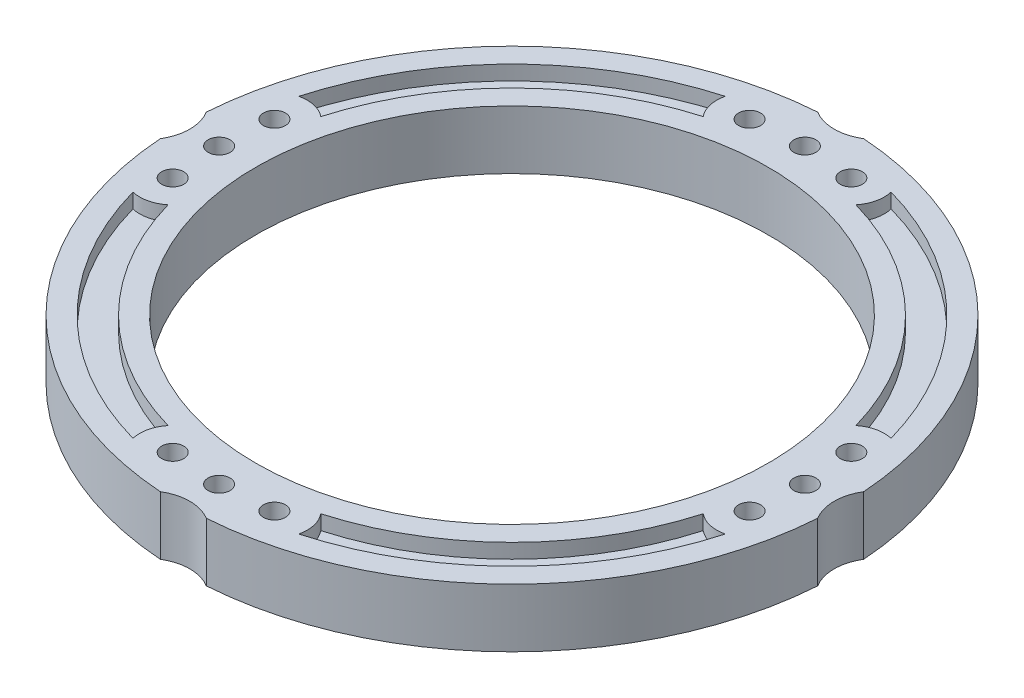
SolidWorks part; units mm, degrees
ref_plane "Front Plane" through (0, 0, 0) normal (0, 0, 1) x (1, 0, 0)
ref_plane "Top Plane" through (0, 0, 0) normal (0, 1, 0) x (1, 0, 0)
ref_plane "Right Plane" through (0, 0, 0) normal (1, 0, 0) x (0, 0, -1)
sketch "Sketch1" plane through (0, 0, 0) normal (0, 1, 0) x (1, 0, 0)
  line L0 (0, 40) -> (0, 0) construction
  line L1 (0, 0) -> (-6.9459, 39.3923) construction
  line L2 (0, 0) -> (6.9459, 39.3923) construction
  circle A0 centre (0, 0) radius 40 construction
  circle A1 centre (0, 40) radius 1.5
  circle A2 centre (40, 0) radius 1.5
  circle A3 centre (0, -40) radius 1.5
  circle A4 centre (-40, 0) radius 1.5
  circle A5 centre (0, 0) radius 35
  circle A6 centre (0, 0) radius 45
  circle A7 centre (6.9459, 39.3923) radius 1.5
  circle A8 centre (-6.9459, 39.3923) radius 1.5
  circle A9 centre (39.3923, 6.9459) radius 1.5
  circle A10 centre (39.3923, -6.9459) radius 1.5
  circle A11 centre (6.9459, -39.3923) radius 1.5
  circle A12 centre (-6.9459, -39.3923) radius 1.5
  circle A13 centre (-39.3923, -6.9459) radius 1.5
  circle A14 centre (-39.3923, 6.9459) radius 1.5
  point P14 (0, 0)
  point P33 (0, 0)
  dimension "D1" = 80
  dimension "D2" = 3
  dimension "D4" = 5
  dimension "D5" = 5
  dimension "D6" = 3
  dimension "D7" = 3
  dimension "D8" = 10
  dimension "D9" = 10
  dimension "D3" = 4
  dimension "D10" = 4
extrude "Boss-Extrude1" add sketch "Sketch1" along normal blind 8
sketch "Sketch2" plane through (0, 8, 0) normal (0, 1, 0) x (1, 0, 0)
  circle A5 centre (0, 0) radius 38
  circle A6 centre (0, 0) radius 38
  circle A8 centre (0, 0) radius 42
  circle A9 centre (0, 0) radius 42
  circle A14 centre (-6.9459, 39.3923) radius 4.5
  circle A15 centre (-6.9459, 39.3923) radius 4.5
  circle A16 centre (39.3923, 6.9459) radius 4.5
  circle A17 centre (6.9459, 39.3923) radius 4.5
  circle A18 centre (6.9459, 39.3923) radius 4.5
  circle A19 centre (39.3923, -6.9459) radius 4.5
  circle A20 centre (6.9459, -39.3923) radius 4.5
  circle A21 centre (-6.9459, -39.3923) radius 4.5
  circle A22 centre (-39.3923, -6.9459) radius 4.5
  circle A23 centre (-39.3923, 6.9459) radius 4.5
  point P27 (0, 0)
  dimension "D1" = 3
  dimension "D2" = 3
  dimension "D3" = 3
  dimension "D4" = 3
  dimension "D5" = 4
extrude "Cut-Extrude1" cut sketch "Sketch2" against normal blind 2 contours A23 A6 A15 A9 | A18 A6 A16 A9 | A20 A9 A19 A6 | A22 A9 A21 A6
sketch "Sketch3" plane through (0, 0, 0) normal (0, -1, 0) x (1, 0, 0)
  circle A2 centre (0, 0) radius 38
  circle A3 centre (0, 0) radius 38
  circle A5 centre (0, 0) radius 42
  circle A6 centre (0, 0) radius 42
  circle A8 centre (-6.9459, 39.3923) radius 4.5
  circle A9 centre (-6.9459, 39.3923) radius 4.5
  circle A10 centre (39.3923, -6.9459) radius 4.5
  circle A11 centre (6.9459, 39.3923) radius 4.5
  circle A12 centre (6.9459, 39.3923) radius 4.5
  circle A13 centre (39.3923, 6.9459) radius 4.5
  circle A14 centre (-6.9459, -39.3923) radius 4.5
  circle A15 centre (6.9459, -39.3923) radius 4.5
  circle A16 centre (-39.3923, 6.9459) radius 4.5
  circle A17 centre (-39.3923, -6.9459) radius 4.5
  point P27 (0, 0)
  dimension "D1" = 3
  dimension "D2" = 3
  dimension "D3" = 3
  dimension "D4" = 3
  dimension "D5" = 4
extrude "Cut-Extrude2" cut sketch "Sketch3" against normal blind 2 contours A15 A6 A10 A3 | A17 A6 A14 A3 | A16 A3 A9 A6 | A13 A6 A12 A3
sketch "Sketch4" plane through (0, 0, 0) normal (0, -1, 0) x (-1, 0, 0)
  circle A0 centre (0, 0) radius 50
  circle A1 centre (0, 50) radius 6
  circle A2 centre (50, 0) radius 6
  circle A3 centre (0, -50) radius 6
  circle A4 centre (-50, 0) radius 6
  point P14 (0, 0)
  dimension "D1" = 100
  dimension "D2" = 12
  dimension "D3" = 4
extrude "Cut-Extrude3" cut sketch "Sketch4" against normal blind 10 contours A2 M11 | A3 M11 | A4 M11 | A1 M11
